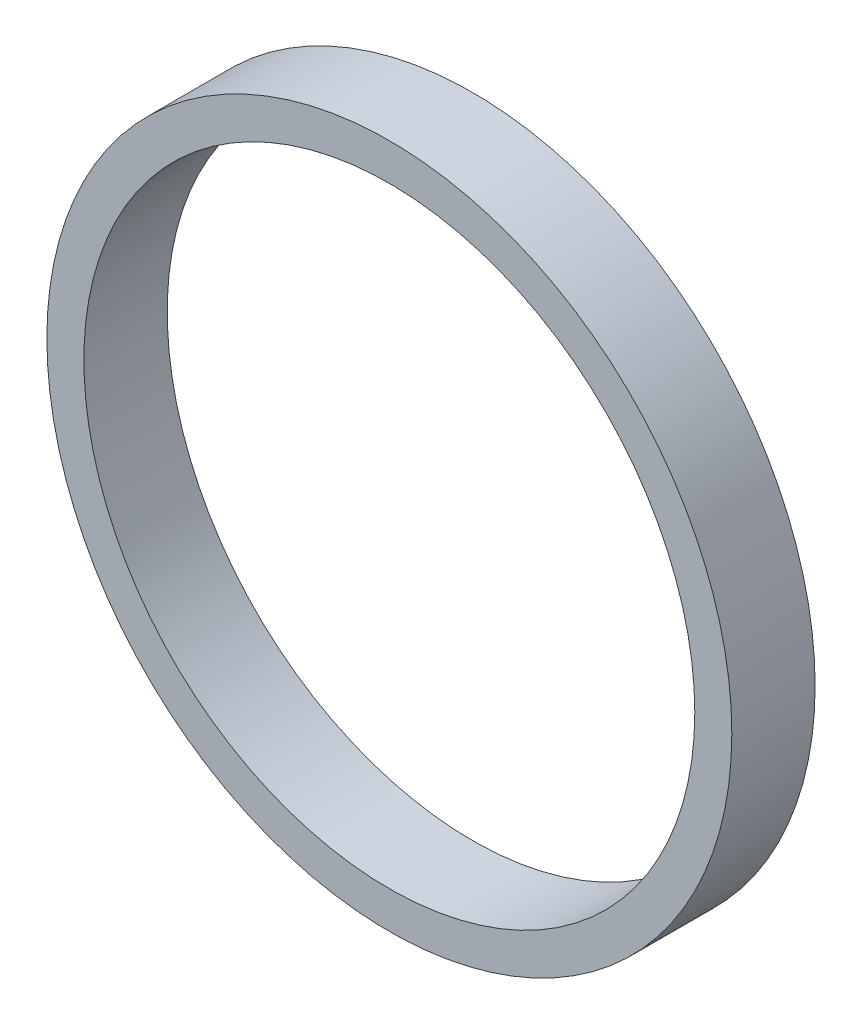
SolidWorks part; units mm, degrees
ref_plane "Front Plane" through (0, 0, 0) normal (0, 0, 1) x (1, 0, 0)
ref_plane "Top Plane" through (0, 0, 0) normal (0, 1, 0) x (1, 0, 0)
ref_plane "Right Plane" through (0, 0, 0) normal (1, 0, 0) x (0, 0, -1)
sketch "Sketch1" plane through (0, 0, 0) normal (0, 0, 1) x (1, 0, 0)
  circle A0 centre (0, 0) radius 46.99
  circle A1 centre (0, 0) radius 41.91
  dimension "D1" = 5.08
  dimension "D2" = 93.98
extrude "Boss-Extrude1" add sketch "Sketch1" along normal mid plane 11.43
